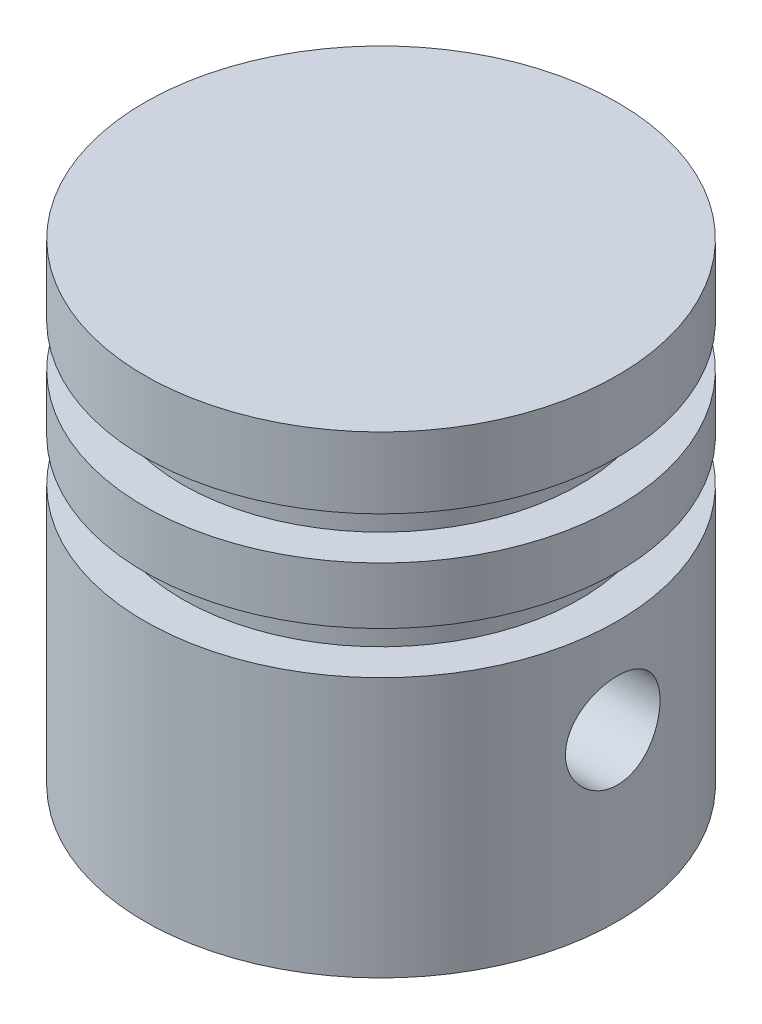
SolidWorks part; units mm, degrees
ref_plane "Płaszczyzna przednia" through (0, 0, 0) normal (0, 0, 1) x (1, 0, 0)
ref_plane "Płaszczyzna górna" through (0, 0, 0) normal (0, 1, 0) x (1, 0, 0)
ref_plane "Płaszczyzna prawa" through (0, 0, 0) normal (1, 0, 0) x (0, 0, -1)
sketch "Szkic1" plane through (0, 0, 0) normal (0, 0, 1) x (1, 0, 0)
  line L0 (0, 0) -> (0, 100) construction
  line L1 (0, 100) -> (50, 100)
  line L2 (50, 100) -> (50, 85)
  line L3 (50, 85) -> (42, 85)
  line L4 (42, 85) -> (42, 76)
  line L5 (42, 76) -> (50, 76)
  line L6 (50, 76) -> (50, 64)
  line L7 (50, 64) -> (42, 64)
  line L8 (42, 64) -> (42, 55)
  line L9 (42, 55) -> (50, 55)
  line L10 (50, 55) -> (50, 0)
  line L11 (50, 0) -> (29.7289, 0)
  line L12 (29.7289, 0) -> (29.7289, 60)
  line L13 (29.7289, 60) -> (12.4084, 90)
  line L14 (12.4084, 90) -> (0, 90)
  line L15 (0, 90) -> (0, 100)
  dimension "D1" = 59.4578
  dimension "D2" = 100
  dimension "D3" = 15
  dimension "D4" = 9
  dimension "D5" = 12
  dimension "D6" = 100
  dimension "D7" = 10
  dimension "D8" = 60
  dimension "D9" = 120
  dimension "D10" = 8
revolve "Obrót1" add sketch "Szkic1" angle 360 about L0
sketch "Szkic2" plane through (0, 0, 0) normal (1, 0, 0) x (0, 0, -1)
  line L0 (0, 0) -> (0, 43.7413) construction
  circle A0 centre (0, 35) radius 10
  circle A1 centre (0, 35) radius 15
  dimension "D2" = 30
  dimension "D3" = 20
  dimension "D1" = 35
extrude "Dodanie-wyciągnięcie1" add sketch "Szkic2" along normal up to next and the other way up to next
sketch "Szkic3" plane through (0, 0, 0) normal (1, 0, 0) x (0, 0, -1)
  line L0 (0, 0) -> (0, 43.6635) construction
  circle A0 centre (0, 35) radius 10
  dimension "D1" = 20
  dimension "D2" = 35
extrude "Wytnij-wyciągnięcie1" cut sketch "Szkic3" against normal through all both and the other way through all contours A0
sketch "Szkic4" plane through (0, 0, 0) normal (1, 0, 0) x (0, 0, -1)
  line L0 (0, 0) -> (0, 59.7069) construction
  circle A0 centre (0, 35) radius 15
  dimension "D1" = 30
extrude "Wytnij-wyciągnięcie2" cut sketch "Szkic4" against normal mid plane 20
